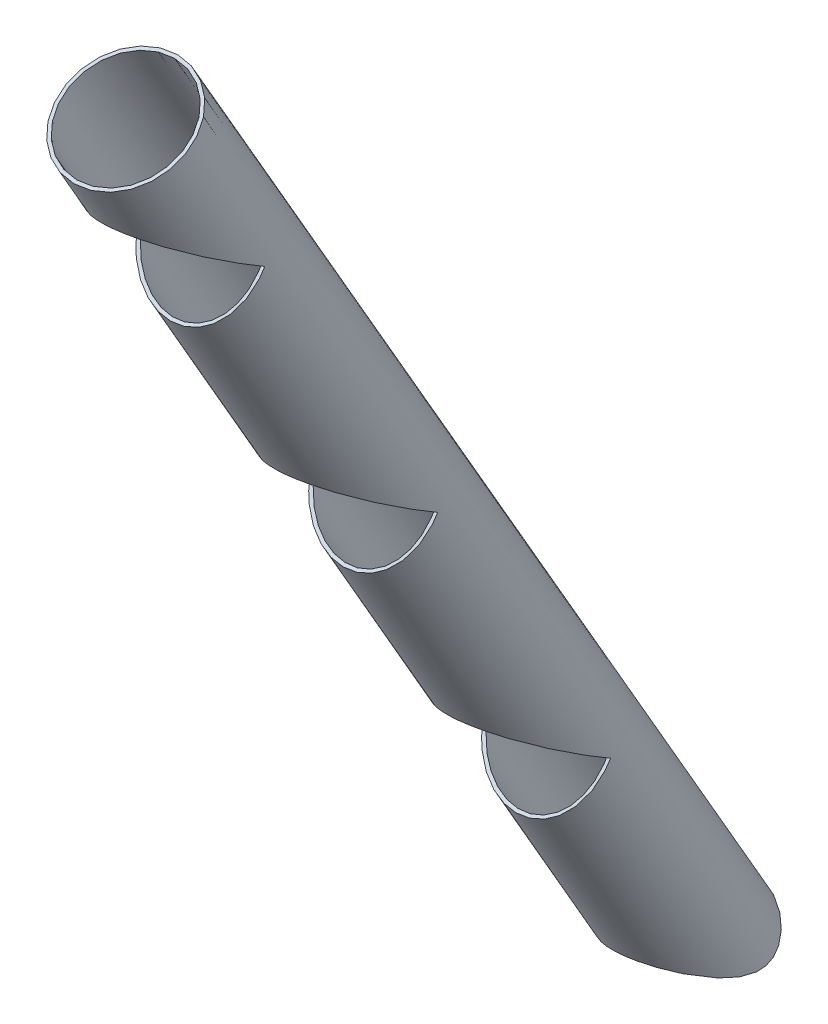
SolidWorks part; units mm, degrees
ref_plane "Ebene vorne" through (0, 0, 0) normal (0, 0, 1) x (1, 0, 0)
ref_plane "Ebene oben" through (0, 0, 0) normal (0, 1, 0) x (1, 0, 0)
ref_plane "Ebene rechts" through (0, 0, 0) normal (1, 0, 0) x (0, 0, -1)
imported_body "Importiert1"
sketch "Skizze1" plane through (0, 643.528, 371.5411) normal (0, 0.866, 0.5) x (1, 0, 0)
  line L0 (0, 0) -> (0, -41.6205) construction
  line L1 (-0.005, -41.6205) -> (0.005, -41.6205)
  line L2 (-0.005, -41.6205) -> (-0.005, -43.6205)
  line L3 (-0.005, -43.6205) -> (0.005, -43.6205)
  line L4 (0.005, -41.6205) -> (0.005, -43.6205)
  circle A0 centre (0, -76.6205) radius 33 construction
  circle A1 centre (0, -76.6205) radius 35 construction
  point P7 (7.543, -44.4941)
  dimension "D1" = 0.01
extrude "Schnitt-Linear austragen1" cut sketch "Skizze1" against normal through all
flatten bends "Abwickeln1" thickness 2 parameters "D1"=0
sketch "Skizze-Winkel1" plane through (-0.005, 332.6089, 240.091) normal (-0.0001, 0.5, -0.866) x (-1, -0.0001, 0.0001)
  line L0 (106.8093, 334.9889) -> (106.8093, -334.9889) construction
bend "Biegung-Rundung1" bend radius 33 bend angle 359.984 parameters "D5"=1
process bends "Abbiegen1" thickness 2 parameters "D1"=0
sketch "Abwicklung-Skizze1" plane through (-0.005, 332.6089, 240.091) normal (-0.0001, 0.5, -0.866) x (-1, -0.0001, 0.0001)
sketch "Biegung-Linien1" [suppressed] plane through (0, 0, 0) normal (0, 1, 0) x (1, 0, 0)
sketch "Rahmen1" [suppressed] plane through (0, 0, 0) normal (0, 1, 0) x (1, 0, 0)
sheet metal parameters "Blech3" thickness 2 parameters "D1"=1
flat pattern "Abwicklung3"
sketch "Biegung-Linien2" plane through (0.0059, -20.8102, 36.0444) normal (-0.0001, 0.5, -0.866) x (-1, -0.0001, 0.0001)
  line L0 (106.8202, 743.0822) -> (106.8202, 113.5189) construction
  line L1 (106.8202, 743.0822) -> (106.8202, 711.0764) construction
  line L2 (106.8202, 630.2474) -> (106.8202, 509.0038) construction
  line L3 (106.8202, 428.1748) -> (106.8202, 306.9312) construction
  line L4 (106.8202, 226.1022) -> (106.8202, 113.5189) construction
sketch3d "Rahmen2" [suppressed]
  line L0 (-106.8093, 334.9889, 0) -> (-106.8093, -339.7464, 0) construction
  line L1 (106.8093, 334.9889, 0) -> (106.8093, -339.7463, 0) construction
  line L2 (-106.8093, 334.9889, 0) -> (106.8093, 334.9889, 0) construction
  line L3 (-106.8093, -339.7464, 0) -> (106.8093, -339.7463, 0) construction
bend of the flat pattern "Abwickeln-<Biegung-Rundung1>1"
